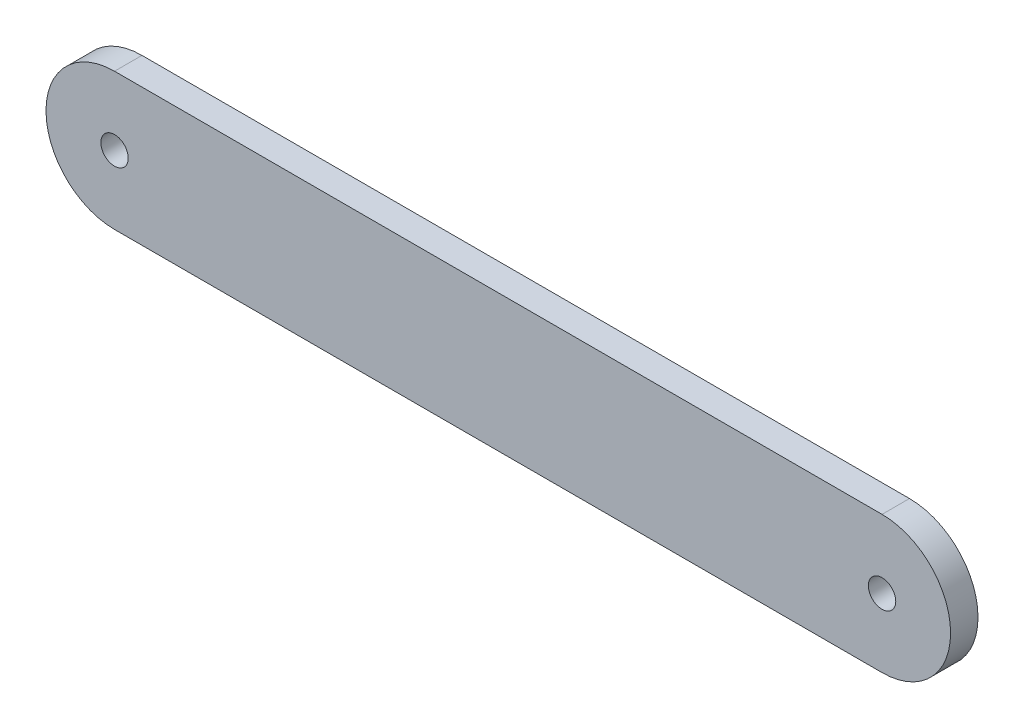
SolidWorks part; units mm, degrees
ref_plane "Plan de face" through (0, 0, 0) normal (0, 0, 1) x (1, 0, 0)
ref_plane "Plan de dessus" through (0, 0, 0) normal (0, 1, 0) x (1, 0, 0)
ref_plane "Plan de droite" through (0, 0, 0) normal (1, 0, 0) x (0, 0, -1)
sketch "Esquisse1" plane through (0, 0, 0) normal (0, 0, 1) x (1, 0, 0)
  line L0 (0, 0) -> (280, 0) construction
  line L1 (0, 25) -> (280, 25)
  line L2 (0, -25) -> (280, -25)
  arc A0 (0, 25) -> (0, -25) centre (0, 0) ccw
  arc A1 (280, -25) -> (280, 25) centre (280, 0) ccw
  point P3 (140, 0)
  dimension "D1" = 50
  dimension "D2" = 280
extrude "Boss.-Extru.1" add sketch "Esquisse1" along normal blind 10
sketch "Esquisse2" plane through (0, 0, 10) normal (0, 0, 1) x (1, 0, 0)
  circle A0 centre (0, 0) radius 5
  circle A1 centre (280, 0) radius 5
  dimension "D1" = 10
  dimension "D2" = 10
extrude "Enlèv. mat.-Extru.1" cut sketch "Esquisse2" against normal through all
